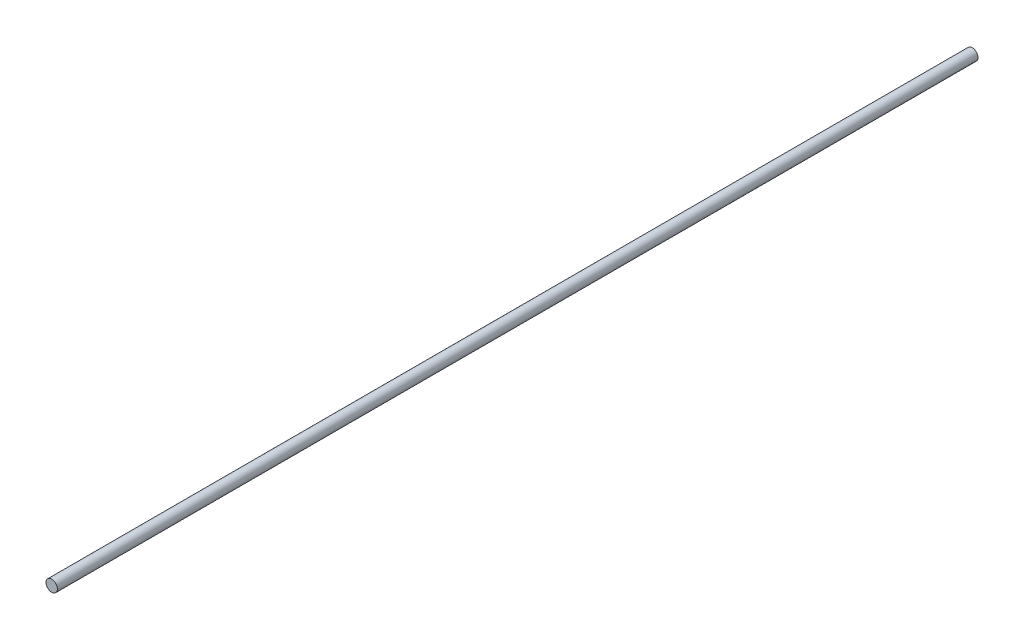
SolidWorks part; units mm, degrees
ref_plane "Front Plane" through (0, 0, 0) normal (0, 0, 1) x (1, 0, 0)
ref_plane "Top Plane" through (0, 0, 0) normal (0, 1, 0) x (1, 0, 0)
ref_plane "Right Plane" through (0, 0, 0) normal (1, 0, 0) x (0, 0, -1)
sketch "Sketch1" plane through (0, 0, 0) normal (0, 0, 1) x (1, 0, 0)
  circle A0 centre (0, 0) radius 30
  dimension "D1" = 60
extrude "Boss-Extrude1" add sketch "Sketch1" against normal blind 4850
